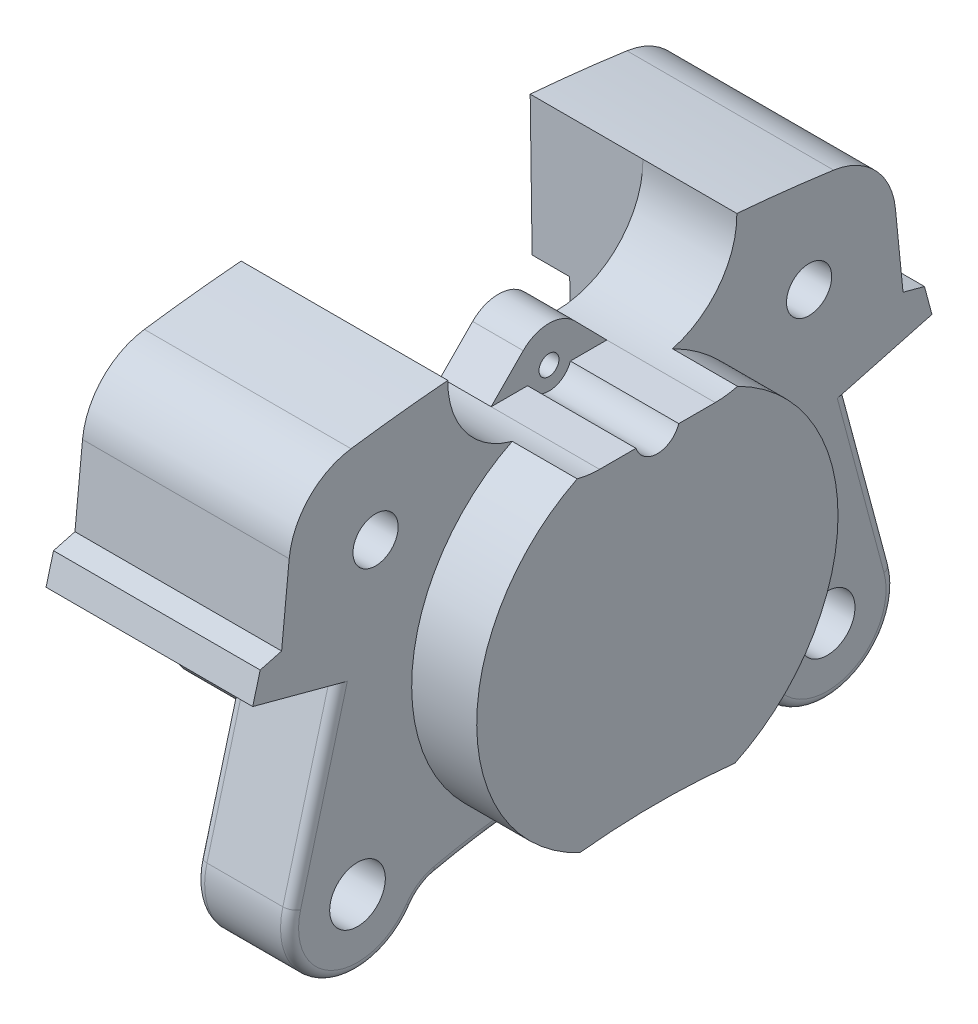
SolidWorks part; units mm, degrees
ref_plane "Front" through (0, 0, 0) normal (0, 0, 1) x (1, 0, 0)
ref_plane "Top" through (0, 0, 0) normal (0, 1, 0) x (1, 0, 0)
ref_plane "Right" through (0, 0, 0) normal (1, 0, 0) x (0, 0, -1)
sketch "Sketch1" plane through (0, 0, 0) normal (1, 0, 0) x (0, 0, -1)
  circle A0 centre (0, 0) radius 31.75
  dimension "D1" = 63.5
extrude "Base-Extrude" add sketch "Sketch1" against normal blind 11.43
sketch "Sketch2" plane through (-11.43, 0, 0) normal (-1, 0, 0) x (0, 0, 1)
  line L0 (41.275, -26.924) -> (-41.275, -26.924) construction
  line L1 (0, 0) -> (0, -26.924) construction
  line L2 (-52.8062, -23.8342) -> (-44.5887, 6.8339)
  line L3 (-44.5887, 6.8339) -> (-59.69, 10.8803)
  line L4 (-59.69, 10.8803) -> (-58.3752, 15.7872)
  line L5 (-58.3752, 15.7872) -> (-54.61, 16.7961)
  line L6 (38.1, 25.4635) -> (-38.1, 25.4635) construction
  line L7 (0, 0) -> (0, 25.4635) construction
  line L8 (-53.2774, 30.1684) -> (-54.61, 16.7961)
  line L9 (52.8062, -23.8342) -> (44.5887, 6.8339)
  line L10 (44.5887, 6.8339) -> (59.69, 10.8803)
  line L11 (59.69, 10.8803) -> (58.3752, 15.7872)
  line L12 (58.3752, 15.7872) -> (54.61, 16.7961)
  line L13 (53.2774, 30.1684) -> (54.61, 16.7961)
  line L14 (10.1614, 27.94) -> (-10.1614, 27.94)
  line L15 (0, 25.4635) -> (0, 27.94) construction
  circle A0 centre (41.275, -26.924) radius 4.8895
  circle A1 centre (-41.275, -26.924) radius 4.8895
  arc A2 (30.2934, -31.6059) -> (52.8062, -23.8342) centre (41.275, -26.924) ccw
  arc A3 (-52.8062, -23.8342) -> (-30.2934, -31.6059) centre (-41.275, -26.924) ccw
  arc A4 (-30.2934, -31.6059) -> (30.2934, -31.6059) centre (0, -154.94) cw
  circle A5 centre (-38.1, 25.4635) radius 3.9687
  circle A6 centre (38.1, 25.4635) radius 3.9687
  arc A7 (-42.407, 41.4855) -> (-25.4, 43.3898) centre (0, -260.35) cw
  arc A8 (-53.2774, 30.1684) -> (-42.407, 41.4855) centre (-40.64, 28.9091) cw
  arc A9 (53.2774, 30.1684) -> (42.407, 41.4855) centre (40.64, 28.9091) ccw
  arc A10 (-25.4, 43.3898) -> (-10.1614, 27.94) centre (-10.1614, 43.18) ccw
  arc A11 (25.4, 43.3898) -> (10.1614, 27.94) centre (10.1614, 43.18) cw
  arc A12 (25.4, 43.3898) -> (42.407, 41.4855) centre (0, -260.35) cw
  dimension "D2" = 9.779
  dimension "D4" = 11.938
  dimension "D6" = 127
  dimension "D10" = 7.9375
  dimension "D13" = 304.8
  dimension "D16" = 12.7
  dimension "D21" = 15.24
  dimension "D1" = 82.55
  dimension "D3" = 26.924
  dimension "D5" = 27.94
  dimension "D7" = 15
  dimension "D8" = 109.22
  dimension "D9" = 31.75
  dimension "D11" = 76.2
  dimension "D12" = 52.3875
  dimension "D14" = 44.45
  dimension "D15" = 5.08
  dimension "D17" = 30
  dimension "D18" = 106.68
  dimension "D19" = 119.38
  dimension "D20" = 55.88
  dimension "D22" = 50.8
extrude "Boss-Extrude1" add sketch "Sketch2" along normal blind 16.51
sketch "Sketch3" plane through (-11.43, 0, 0) normal (-1, 0, 0) x (0, 0, 1)
  line L1 (-10.1614, 27.94) -> (10.1614, 27.94)
  line L2 (-10.1614, 27.94) -> (10.1614, 27.94)
  arc A2 (13.6334, -28.6739) -> (-13.6334, -28.6739) centre (0, -154.94) ccw
  arc A3 (14.0864, 28.4541) -> (-14.0864, 28.4541) centre (0, 0) ccw
  arc A4 (-14.0864, 28.4541) -> (-10.1614, 27.94) centre (-10.1614, 43.18) ccw
  arc A5 (10.1614, 27.94) -> (14.0864, 28.4541) centre (10.1614, 43.18) ccw
  arc A6 (14.0864, 28.4541) -> (-14.0864, 28.4541) centre (0, 0) ccw
  arc A7 (-14.0864, 28.4541) -> (-10.1614, 27.94) centre (-10.1614, 43.18) ccw
  arc A8 (10.1614, 27.94) -> (14.0864, 28.4541) centre (10.1614, 43.18) ccw
  arc A9 (-13.6334, -28.6739) -> (13.6334, -28.6739) centre (0, 0) ccw
  arc A10 (13.6334, -28.6739) -> (-13.6334, -28.6739) centre (0, -154.94) ccw
  arc A11 (-13.6334, -28.6739) -> (13.6334, -28.6739) centre (0, 0) ccw
  dimension "D1" = 0
  dimension "D2" = 0
extrude "Cut-Extrude1" cut sketch "Sketch3" against normal up to next
sketch "Sketch4" plane through (-27.94, 0, 0) normal (-1, 0, 0) x (0, 0, 1)
  line L0 (-25.4, 43.3898) -> (-26.1233, -9.144)
  line L1 (-37.3721, -9.144) -> (-26.1233, -9.144)
  line L2 (-44.5887, 6.8339) -> (-43.698, -3.3474)
  line L3 (-52.8062, -23.8342) -> (-44.5887, 6.8339) construction
  line L4 (0, 0) -> (0, 27.94) construction
  line L5 (10.1614, 27.94) -> (-10.1614, 27.94) construction
  line L6 (59.69, 10.8803) -> (44.5887, 6.8339)
  line L7 (58.3752, 15.7872) -> (59.69, 10.8803)
  line L8 (54.61, 16.7961) -> (58.3752, 15.7872)
  line L9 (53.2774, 30.1684) -> (54.61, 16.7961)
  line L10 (44.5887, 6.8339) -> (43.698, -3.3474)
  line L11 (52.8062, -23.8342) -> (44.5887, 6.8339)
  line L12 (44.5887, 6.8339) -> (59.69, 10.8803)
  line L13 (59.69, 10.8803) -> (58.3752, 15.7872)
  line L14 (58.3752, 15.7872) -> (54.61, 16.7961)
  line L15 (54.61, 16.7961) -> (53.2774, 30.1684)
  line L16 (10.1614, 27.94) -> (-10.1614, 27.94)
  line L17 (-53.2774, 30.1684) -> (-54.61, 16.7961)
  line L18 (-54.61, 16.7961) -> (-58.3752, 15.7872)
  line L19 (-58.3752, 15.7872) -> (-59.69, 10.8803)
  line L20 (-59.69, 10.8803) -> (-44.5887, 6.8339)
  line L21 (-44.5887, 6.8339) -> (-52.8062, -23.8342)
  line L22 (37.3721, -9.144) -> (26.1233, -9.144)
  line L23 (25.4, 43.3898) -> (26.1233, -9.144)
  line L28 (-53.2774, 30.1684) -> (-54.61, 16.7961)
  line L29 (-54.61, 16.7961) -> (-58.3752, 15.7872)
  line L30 (-58.3752, 15.7872) -> (-59.69, 10.8803)
  line L31 (-59.69, 10.8803) -> (-44.5887, 6.8339)
  arc A0 (-43.698, -3.3474) -> (-37.3721, -9.144) centre (-37.3721, -2.794) ccw
  circle A1 centre (-38.1, 25.4635) radius 3.9688 construction
  circle A2 centre (-38.1, 25.4635) radius 3.9687
  arc A3 (42.407, 41.4855) -> (53.2774, 30.1684) centre (40.64, 28.9091) cw
  arc A4 (25.4, 43.3898) -> (42.407, 41.4855) centre (0, -260.35) cw
  circle A5 centre (38.1, 25.4635) radius 3.9687
  arc A6 (43.698, -3.3474) -> (37.3721, -9.144) centre (37.3721, -2.794) cw
  arc A9 (30.2934, -31.6059) -> (-30.2934, -31.6059) centre (0, -154.94) ccw
  arc A10 (30.2934, -31.6059) -> (52.8062, -23.8342) centre (41.275, -26.924) ccw
  arc A11 (53.2774, 30.1684) -> (42.407, 41.4855) centre (40.64, 28.9091) ccw
  arc A12 (42.407, 41.4855) -> (25.4, 43.3898) centre (0, -260.35) ccw
  arc A13 (10.1614, 27.94) -> (25.4, 43.3898) centre (10.1614, 43.18) ccw
  arc A14 (-25.4, 43.3898) -> (-10.1614, 27.94) centre (-10.1614, 43.18) ccw
  arc A15 (-25.4, 43.3898) -> (-42.407, 41.4855) centre (0, -260.35) ccw
  arc A16 (-42.407, 41.4855) -> (-53.2774, 30.1684) centre (-40.64, 28.9091) ccw
  arc A17 (-52.8062, -23.8342) -> (-30.2934, -31.6059) centre (-41.275, -26.924) ccw
  arc A24 (-25.4, 43.3898) -> (-42.407, 41.4855) centre (0, -260.35) ccw
  arc A25 (-42.407, 41.4855) -> (-53.2774, 30.1684) centre (-40.64, 28.9091) ccw
  dimension "D3" = 6.35
  dimension "D2" = 17.78
  dimension "D4" = 20
  dimension "D1" = 0
extrude "Boss-Extrude2" add sketch "Sketch4" along normal blind 13.208
sketch "Sketch5" plane through (-41.148, 0, 0) normal (-1, 0, 0) x (0, 0, 1)
  line L0 (-25.4, 43.3898) -> (-25.7395, 18.735)
  line L1 (59.69, 10.8803) -> (44.5887, 6.8339) construction
  line L2 (0, 0) -> (0, -118.5733) construction
  line L3 (-54.61, 16.7961) -> (-53.2774, 30.1684)
  line L4 (-58.3752, 15.7872) -> (-54.61, 16.7961)
  line L5 (-59.69, 10.8803) -> (-58.3752, 15.7872)
  line L6 (-55.3163, 9.7084) -> (-59.69, 10.8803)
  line L7 (43.698, -3.3474) -> (44.5887, 6.8339)
  line L8 (44.5887, 6.8339) -> (59.69, 10.8803)
  line L9 (59.69, 10.8803) -> (58.3752, 15.7872)
  line L10 (58.3752, 15.7872) -> (54.61, 16.7961)
  line L11 (54.61, 16.7961) -> (53.2774, 30.1684)
  line L12 (25.4, 43.3898) -> (26.1233, -9.144)
  line L13 (26.1233, -9.144) -> (37.3721, -9.144)
  line L15 (55.3163, 9.7084) -> (59.69, 10.8803)
  line L16 (59.69, 10.8803) -> (58.3752, 15.7872)
  line L17 (58.3752, 15.7872) -> (54.61, 16.7961)
  line L18 (54.61, 16.7961) -> (53.2774, 30.1684)
  line L19 (25.4, 43.3898) -> (25.7395, 18.735)
  arc A0 (55.3163, 9.7084) -> (25.7395, 18.735) centre (0, -118.5733) ccw
  circle A1 centre (38.1, 25.4635) radius 3.9688 construction
  circle A2 centre (38.1, 25.4635) radius 3.9687
  arc A3 (53.2774, 30.1684) -> (42.407, 41.4855) centre (40.64, 28.9091) ccw
  arc A4 (42.407, 41.4855) -> (25.4, 43.3898) centre (0, -260.35) ccw
  arc A5 (37.3721, -9.144) -> (43.698, -3.3474) centre (37.3721, -2.794) ccw
  arc A6 (53.2774, 30.1684) -> (42.407, 41.4855) centre (40.64, 28.9091) ccw
  arc A7 (42.407, 41.4855) -> (25.4, 43.3898) centre (0, -260.35) ccw
  arc A8 (42.407, 41.4855) -> (25.4, 43.3898) centre (0, -260.35) ccw construction
  arc A9 (-42.407, 41.4855) -> (-25.4, 43.3898) centre (0, -260.35) cw
  arc A10 (-53.2774, 30.1684) -> (-42.407, 41.4855) centre (-40.64, 28.9091) cw
  circle A11 centre (-38.1, 25.4635) radius 3.9687
  arc A12 (-55.3163, 9.7084) -> (-25.7395, 18.735) centre (0, -118.5733) cw
  dimension "D2" = 139.7
  dimension "D1" = 0
extrude "Boss-Extrude3" add sketch "Sketch5" along normal blind 6.604
sketch "Sketch6" plane through (-27.94, 0, 0) normal (-1, 0, 0) x (0, 0, 1)
  line L0 (4.525, 33.665) -> (10.1614, 27.94)
  line L1 (-4.525, 33.665) -> (-10.1614, 27.94)
  line L2 (0, 0) -> (0, 29.21) construction
  line L3 (10.1614, 27.94) -> (-10.1614, 27.94) construction
  line L4 (10.1614, 27.94) -> (-10.1614, 27.94)
  circle A0 centre (0, 29.21) radius 1.7526 construction
  arc A1 (4.525, 33.665) -> (-4.525, 33.665) centre (0, 29.21) ccw
  arc A2 (30.2934, -31.6059) -> (-30.2934, -31.6059) centre (0, -154.94) ccw construction
  dimension "D1" = 12.7
  dimension "D2" = 3.5052
  dimension "D3" = 63.5
  dimension "D4" = 35.56
extrude "Boss-Extrude4" add sketch "Sketch6" against normal blind 8.89
sketch "Sketch7" plane through (-19.05, 0, 0) normal (1, 0, 0) x (0, 0, -1)
  circle A1 centre (0, 29.21) radius 3.9688
  dimension "D1" = 7.9375
extrude "Cut-Extrude2" cut sketch "Sketch7" along normal through all
sketch "Sketch8" plane through (-19.05, 0, 0) normal (1, 0, 0) x (0, 0, -1)
  circle A0 centre (0, 29.21) radius 1.7526 construction
  circle A1 centre (0, 29.21) radius 1.7526
extrude "Cut-Extrude3" cut sketch "Sketch8" against normal through all
fillet "Fillet1" radius 6.35 2 edges at (-19.685, -31.6059, 30.2934) (-19.685, -31.6059, -30.2934)
fillet "Fillet2" radius 1.5875 15 edges at (-11.43, -29.6205, -20.5919) (-11.43, -31.901, -29.687) (-11.43, -37.7872, -46.2254) (-27.94, -8.5001, 48.6975) (-27.94, -37.7872, 46.2254) (-27.94, -31.901, 29.687) (-27.94, -27.94, 0) (-27.94, -31.901, -29.687) (-27.94, -37.7872, -46.2254) (-11.43, -8.5001, -48.6975) (-27.94, -8.5001, -48.6975) (-11.43, -29.6205, 20.5919) (-11.43, -31.901, 29.687) (-11.43, -8.5001, 48.6975) (-11.43, -37.7872, 46.2254)
